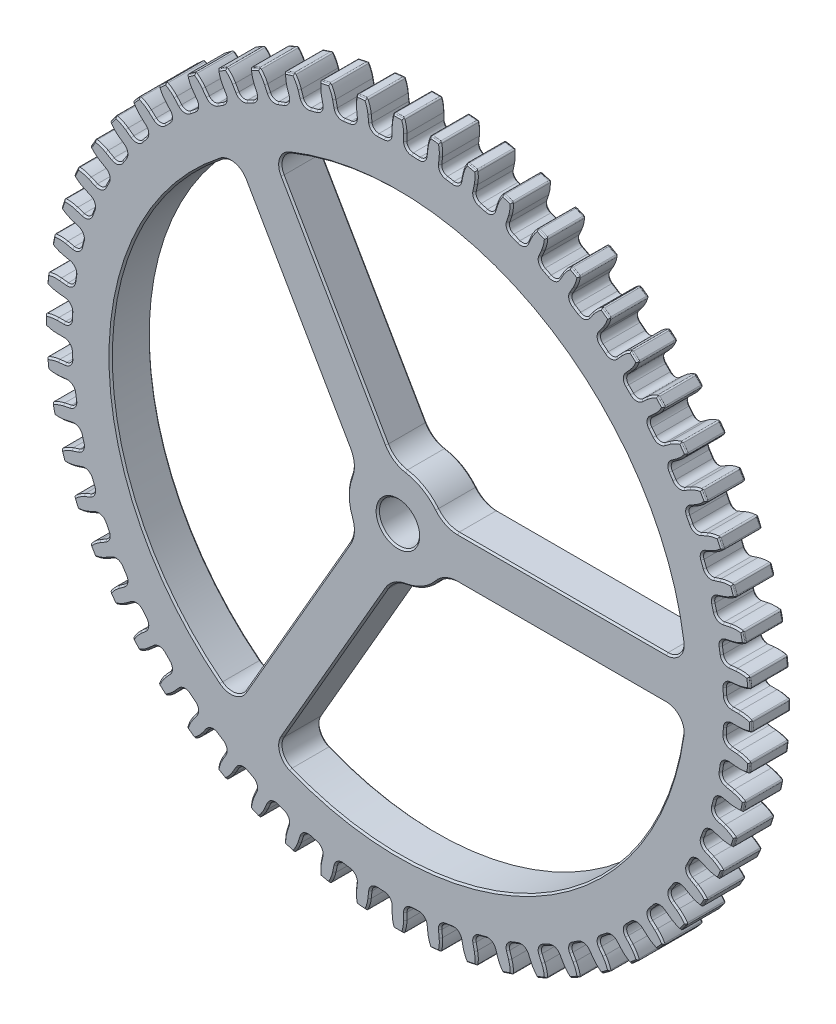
SolidWorks part; units mm, degrees
ref_plane "Спереди" through (0, 0, 0) normal (0, 0, 1) x (1, 0, 0)
ref_plane "Сверху" through (0, 0, 0) normal (0, 1, 0) x (1, 0, 0)
ref_plane "Справа" through (0, 0, 0) normal (1, 0, 0) x (0, 0, -1)
sketch "Эскиз1" plane through (0, 0, 0) normal (0, 0, 1) x (1, 0, 0)
  line L0 (0, 0) -> (0, 52.7) construction
  line L1 (0, 0) -> (-24.4375, 42.327) construction
  line L2 (-7.278, 6.1058) -> (-22.8555, 33.0868)
  line L3 (8.9268, 3.25) -> (40.0817, 3.25)
  line L4 (-1.6488, 9.3558) -> (-17.2263, 36.3368)
  line L5 (8.9268, -3.25) -> (40.0817, -3.25)
  line L6 (-1.6488, -9.3558) -> (-17.2263, -36.3368)
  line L7 (-7.278, -6.1058) -> (-22.8555, -33.0868)
  line L8 (0, 0) -> (42.878, 0) construction
  line L9 (0, 0) -> (-21.439, -37.1334) construction
  line L11 (-1.1, 49.8308) -> (-1.1, 50.8507)
  line L12 (1.1, 49.8308) -> (1.1, 50.8507)
  line L13 (4.1148, 49.6728) -> (4.2214, 50.6871)
  line L14 (6.3027, 49.4428) -> (6.4093, 50.4571)
  line L15 (9.2844, 48.9706) -> (9.4965, 49.9682)
  line L16 (11.4364, 48.5131) -> (11.6484, 49.5108)
  line L17 (14.3524, 47.7318) -> (14.6676, 48.7018)
  line L18 (16.4447, 47.052) -> (16.7599, 48.0219)
  line L19 (19.2631, 45.9701) -> (19.6779, 46.9018)
  line L20 (21.2729, 45.0753) -> (21.6877, 46.007)
  line L21 (23.9628, 43.7047) -> (24.4727, 44.588)
  line L22 (25.868, 42.6047) -> (26.378, 43.488)
  line L23 (28.3999, 40.9605) -> (28.9994, 41.7856)
  line L24 (30.1797, 39.6674) -> (30.7792, 40.4925)
  line L25 (32.5258, 37.7675) -> (33.2083, 38.5255)
  line L26 (34.1608, 36.2954) -> (34.8432, 37.0534)
  line L27 (36.2954, 34.1608) -> (37.0534, 34.8432)
  line L28 (37.7675, 32.5258) -> (38.5255, 33.2083)
  line L29 (39.6674, 30.1797) -> (40.4925, 30.7792)
  line L30 (40.9605, 28.3999) -> (41.7856, 28.9994)
  line L31 (42.6047, 25.868) -> (43.488, 26.378)
  line L32 (43.7047, 23.9628) -> (44.588, 24.4727)
  line L33 (45.0753, 21.2729) -> (46.007, 21.6877)
  line L34 (45.9701, 19.2631) -> (46.9018, 19.6779)
  line L35 (47.052, 16.4447) -> (48.0219, 16.7599)
  line L36 (47.7318, 14.3524) -> (48.7018, 14.6676)
  line L37 (48.5131, 11.4364) -> (49.5108, 11.6484)
  line L38 (48.9706, 9.2844) -> (49.9682, 9.4965)
  line L39 (49.4428, 6.3027) -> (50.4571, 6.4093)
  line L40 (49.6728, 4.1148) -> (50.6871, 4.2214)
  line L41 (49.8308, 1.1) -> (50.8507, 1.1)
  line L42 (49.8308, -1.1) -> (50.8507, -1.1)
  line L43 (49.6728, -4.1148) -> (50.6871, -4.2214)
  line L44 (49.4428, -6.3027) -> (50.4571, -6.4093)
  line L45 (48.9706, -9.2844) -> (49.9682, -9.4965)
  line L46 (48.5131, -11.4364) -> (49.5108, -11.6484)
  line L47 (47.7318, -14.3524) -> (48.7018, -14.6676)
  line L48 (47.052, -16.4447) -> (48.0219, -16.7599)
  line L49 (45.9701, -19.2631) -> (46.9018, -19.6779)
  line L50 (45.0753, -21.2729) -> (46.007, -21.6877)
  line L51 (43.7047, -23.9628) -> (44.588, -24.4727)
  line L52 (42.6047, -25.868) -> (43.488, -26.378)
  line L53 (40.9605, -28.3999) -> (41.7856, -28.9994)
  line L54 (39.6674, -30.1797) -> (40.4925, -30.7792)
  line L55 (37.7675, -32.5258) -> (38.5255, -33.2083)
  line L56 (36.2954, -34.1608) -> (37.0534, -34.8432)
  line L57 (34.1608, -36.2954) -> (34.8432, -37.0534)
  line L58 (32.5258, -37.7675) -> (33.2083, -38.5255)
  line L59 (30.1797, -39.6674) -> (30.7792, -40.4925)
  line L60 (28.3999, -40.9605) -> (28.9994, -41.7856)
  line L61 (25.868, -42.6047) -> (26.378, -43.488)
  line L62 (23.9628, -43.7047) -> (24.4727, -44.588)
  line L63 (21.2729, -45.0753) -> (21.6877, -46.007)
  line L64 (19.2631, -45.9701) -> (19.6779, -46.9018)
  line L65 (16.4447, -47.052) -> (16.7599, -48.0219)
  line L66 (14.3524, -47.7318) -> (14.6676, -48.7018)
  line L67 (11.4364, -48.5131) -> (11.6484, -49.5108)
  line L68 (9.2844, -48.9706) -> (9.4965, -49.9682)
  line L69 (6.3027, -49.4428) -> (6.4093, -50.4571)
  line L70 (4.1148, -49.6728) -> (4.2214, -50.6871)
  line L71 (1.1, -49.8308) -> (1.1, -50.8507)
  line L72 (-1.1, -49.8308) -> (-1.1, -50.8507)
  line L73 (-4.1148, -49.6728) -> (-4.2214, -50.6871)
  line L74 (-6.3027, -49.4428) -> (-6.4093, -50.4571)
  line L75 (-9.2844, -48.9706) -> (-9.4965, -49.9682)
  line L76 (-11.4364, -48.5131) -> (-11.6484, -49.5108)
  line L77 (-14.3524, -47.7318) -> (-14.6676, -48.7018)
  line L78 (-16.4447, -47.052) -> (-16.7599, -48.0219)
  line L79 (-19.2631, -45.9701) -> (-19.6779, -46.9018)
  line L80 (-21.2729, -45.0753) -> (-21.6877, -46.007)
  line L81 (-23.9628, -43.7047) -> (-24.4727, -44.588)
  line L82 (-25.868, -42.6047) -> (-26.378, -43.488)
  line L83 (-28.3999, -40.9605) -> (-28.9994, -41.7856)
  line L84 (-30.1797, -39.6674) -> (-30.7792, -40.4925)
  line L85 (-32.5258, -37.7675) -> (-33.2083, -38.5255)
  line L86 (-34.1608, -36.2954) -> (-34.8432, -37.0534)
  line L87 (-36.2954, -34.1608) -> (-37.0534, -34.8432)
  line L88 (-37.7675, -32.5258) -> (-38.5255, -33.2083)
  line L89 (-39.6674, -30.1797) -> (-40.4925, -30.7792)
  line L90 (-40.9605, -28.3999) -> (-41.7856, -28.9994)
  line L91 (-42.6047, -25.868) -> (-43.488, -26.378)
  line L92 (-43.7047, -23.9628) -> (-44.588, -24.4727)
  line L93 (-45.0753, -21.2729) -> (-46.007, -21.6877)
  line L94 (-45.9701, -19.2631) -> (-46.9018, -19.6779)
  line L95 (-47.052, -16.4447) -> (-48.0219, -16.7599)
  line L96 (-47.7318, -14.3524) -> (-48.7018, -14.6676)
  line L97 (-48.5131, -11.4364) -> (-49.5108, -11.6484)
  line L98 (-48.9706, -9.2844) -> (-49.9682, -9.4965)
  line L99 (-49.4428, -6.3027) -> (-50.4571, -6.4093)
  line L100 (-49.6728, -4.1148) -> (-50.6871, -4.2214)
  line L101 (-49.8308, -1.1) -> (-50.8507, -1.1)
  line L102 (-49.8308, 1.1) -> (-50.8507, 1.1)
  line L103 (-49.6728, 4.1148) -> (-50.6871, 4.2214)
  line L104 (-49.4428, 6.3027) -> (-50.4571, 6.4093)
  line L105 (-48.9706, 9.2844) -> (-49.9682, 9.4965)
  line L106 (-48.5131, 11.4364) -> (-49.5108, 11.6484)
  line L107 (-47.7318, 14.3524) -> (-48.7018, 14.6676)
  line L108 (-47.052, 16.4447) -> (-48.0219, 16.7599)
  line L109 (-45.9701, 19.2631) -> (-46.9018, 19.6779)
  line L110 (-45.0753, 21.2729) -> (-46.007, 21.6877)
  line L111 (-43.7047, 23.9628) -> (-44.588, 24.4727)
  line L112 (-42.6047, 25.868) -> (-43.488, 26.378)
  line L113 (-40.9605, 28.3999) -> (-41.7856, 28.9994)
  line L114 (-39.6674, 30.1797) -> (-40.4925, 30.7792)
  line L115 (-37.7675, 32.5258) -> (-38.5255, 33.2083)
  line L116 (-36.2954, 34.1608) -> (-37.0534, 34.8432)
  line L117 (-34.1608, 36.2954) -> (-34.8432, 37.0534)
  line L118 (-32.5258, 37.7675) -> (-33.2083, 38.5255)
  line L119 (-30.1797, 39.6674) -> (-30.7792, 40.4925)
  line L120 (-28.3999, 40.9605) -> (-28.9994, 41.7856)
  line L121 (-25.868, 42.6047) -> (-26.378, 43.488)
  line L122 (-23.9628, 43.7047) -> (-24.4727, 44.588)
  line L123 (-21.2729, 45.0753) -> (-21.6877, 46.007)
  line L124 (-19.2631, 45.9701) -> (-19.6779, 46.9018)
  line L125 (-16.4447, 47.052) -> (-16.7599, 48.0219)
  line L126 (-14.3524, 47.7318) -> (-14.6676, 48.7018)
  line L127 (-11.4364, 48.5131) -> (-11.6484, 49.5108)
  line L128 (-9.2844, 48.9706) -> (-9.4965, 49.9682)
  line L129 (-6.3027, 49.4428) -> (-6.4093, 50.4571)
  line L130 (-4.1148, 49.6728) -> (-4.2214, 50.6871)
  arc A0 (0.7475, 52.6947) -> (-0.7475, 52.6947) centre (0, 0) ccw
  circle A1 centre (0, 0) radius 51 construction
  arc A2 (-2.0579, 48.8317) -> (-3.0577, 48.7793) centre (0, 0) ccw
  circle A3 centre (0, 0) radius 3
  arc A4 (1.1839, -7.406) -> (5.8218, -4.7283) centre (0, 0) ccw
  arc A5 (42.4582, 5.985) -> (-16.046, 39.7624) centre (0, 0) ccw
  arc A6 (-7.0057, 2.6777) -> (-7.0057, -2.6777) centre (0, 0) ccw
  arc A7 (5.8218, 4.7283) -> (1.1839, 7.406) centre (0, 0) ccw
  arc A8 (-16.046, -39.7624) -> (42.4582, -5.985) centre (0, 0) ccw
  arc A9 (-26.4123, 33.7774) -> (-26.4123, -33.7774) centre (0, 0) ccw
  arc A10 (-22.8555, -33.0868) -> (-26.4123, -33.7774) centre (-24.9339, -31.8868) cw
  arc A11 (-17.2263, -36.3368) -> (-16.046, -39.7624) centre (-15.1478, -37.5368) ccw
  arc A12 (40.0817, -3.25) -> (42.4582, -5.985) centre (40.0817, -5.65) cw
  arc A13 (40.0817, 3.25) -> (42.4582, 5.985) centre (40.0817, 5.65) ccw
  arc A14 (-17.2263, 36.3368) -> (-16.046, 39.7624) centre (-15.1478, 37.5368) cw
  arc A15 (-22.8555, 33.0868) -> (-26.4123, 33.7774) centre (-24.9339, 31.8868) ccw
  arc A16 (-1.6488, -9.3558) -> (1.1839, -7.406) centre (1.8153, -11.3558) cw
  arc A17 (8.9268, -3.25) -> (5.8218, -4.7283) centre (8.9268, -7.25) ccw
  arc A18 (-7.278, -6.1058) -> (-7.0057, -2.6777) centre (-10.7421, -4.1058) ccw
  arc A19 (-7.278, 6.1058) -> (-7.0057, 2.6777) centre (-10.7421, 4.1058) cw
  arc A20 (-1.6488, 9.3558) -> (1.1839, 7.406) centre (1.8153, 11.3558) ccw
  arc A21 (8.9268, 3.25) -> (5.8218, 4.7283) centre (8.9268, 7.25) cw
  arc A22 (-0.7475, 52.6947) -> (-1.1, 50.8507) centre (3.9, 50.8507) ccw
  arc A23 (0.7475, 52.6947) -> (1.1, 50.8507) centre (-3.9, 50.8507) cw
  arc A24 (6.2515, 52.3279) -> (4.7647, 52.4842) centre (0, 0) ccw
  arc A25 (4.7647, 52.4842) -> (4.2214, 50.6871) centre (9.194, 50.1644) ccw
  arc A26 (6.2515, 52.3279) -> (6.4093, 50.4571) centre (1.4367, 50.9798) cw
  arc A27 (11.687, 51.3878) -> (10.2246, 51.6986) centre (0, 0) ccw
  arc A28 (10.2246, 51.6986) -> (9.4965, 49.9682) centre (14.3872, 48.9286) ccw
  arc A29 (11.687, 51.3878) -> (11.6484, 49.5108) centre (6.7577, 50.5503) cw
  arc A30 (16.9945, 49.8846) -> (15.5726, 50.3466) centre (0, 0) ccw
  arc A31 (15.5726, 50.3466) -> (14.6676, 48.7018) centre (19.4228, 47.1567) ccw
  arc A32 (16.9945, 49.8846) -> (16.7599, 48.0219) centre (12.0046, 49.567) cw
  arc A33 (22.1158, 47.835) -> (20.75, 48.443) centre (0, 0) ccw
  arc A34 (20.75, 48.443) -> (19.6779, 46.9018) centre (24.2457, 44.8681) ccw
  arc A35 (22.1158, 47.835) -> (21.6877, 46.007) centre (17.12, 48.0407) cw
  arc A36 (26.9947, 45.2612) -> (25.7, 46.0087) centre (0, 0) ccw
  arc A37 (25.7, 46.0087) -> (24.4727, 44.588) centre (28.8028, 42.088) ccw
  arc A38 (26.9947, 45.2612) -> (26.378, 43.488) centre (22.0478, 45.988) cw
  arc A39 (31.5779, 42.1915) -> (30.3684, 43.0703) centre (0, 0) ccw
  arc A40 (30.3684, 43.0703) -> (28.9994, 41.7856) centre (33.0444, 38.8467) ccw
  arc A41 (31.5779, 42.1915) -> (30.7792, 40.4925) centre (26.7341, 43.4314) cw
  arc A42 (35.8152, 38.6596) -> (34.7041, 39.66) centre (0, 0) ccw
  arc A43 (34.7041, 39.66) -> (33.2083, 38.5255) centre (36.924, 35.1798) ccw
  arc A44 (35.8152, 38.6596) -> (34.8432, 37.0534) centre (31.1275, 40.399) cw
  arc A45 (39.66, 34.7041) -> (38.6596, 35.8152) centre (0, 0) ccw
  arc A46 (38.6596, 35.8152) -> (37.0534, 34.8432) centre (40.399, 31.1275) ccw
  arc A47 (39.66, 34.7041) -> (38.5255, 33.2083) centre (35.1798, 36.924) cw
  arc A48 (43.0703, 30.3684) -> (42.1915, 31.5779) centre (0, 0) ccw
  arc A49 (42.1915, 31.5779) -> (40.4925, 30.7792) centre (43.4314, 26.7341) ccw
  arc A50 (43.0703, 30.3684) -> (41.7856, 28.9994) centre (38.8467, 33.0444) cw
  arc A51 (46.0087, 25.7) -> (45.2612, 26.9947) centre (0, 0) ccw
  arc A52 (45.2612, 26.9947) -> (43.488, 26.378) centre (45.988, 22.0478) ccw
  arc A53 (46.0087, 25.7) -> (44.588, 24.4727) centre (42.088, 28.8028) cw
  arc A54 (48.443, 20.75) -> (47.835, 22.1158) centre (0, 0) ccw
  arc A55 (47.835, 22.1158) -> (46.007, 21.6877) centre (48.0407, 17.12) ccw
  arc A56 (48.443, 20.75) -> (46.9018, 19.6779) centre (44.8681, 24.2457) cw
  arc A57 (50.3466, 15.5726) -> (49.8846, 16.9945) centre (0, 0) ccw
  arc A58 (49.8846, 16.9945) -> (48.0219, 16.7599) centre (49.567, 12.0046) ccw
  arc A59 (50.3466, 15.5726) -> (48.7018, 14.6676) centre (47.1567, 19.4228) cw
  arc A60 (51.6986, 10.2246) -> (51.3878, 11.687) centre (0, 0) ccw
  arc A61 (51.3878, 11.687) -> (49.5108, 11.6484) centre (50.5503, 6.7577) ccw
  arc A62 (51.6986, 10.2246) -> (49.9682, 9.4965) centre (48.9286, 14.3872) cw
  arc A63 (52.4842, 4.7647) -> (52.3279, 6.2515) centre (0, 0) ccw
  arc A64 (52.3279, 6.2515) -> (50.4571, 6.4093) centre (50.9798, 1.4367) ccw
  arc A65 (52.4842, 4.7647) -> (50.6871, 4.2214) centre (50.1644, 9.194) cw
  arc A66 (52.6947, -0.7475) -> (52.6947, 0.7475) centre (0, 0) ccw
  arc A67 (52.6947, 0.7475) -> (50.8507, 1.1) centre (50.8507, -3.9) ccw
  arc A68 (52.6947, -0.7475) -> (50.8507, -1.1) centre (50.8507, 3.9) cw
  arc A69 (52.3279, -6.2515) -> (52.4842, -4.7647) centre (0, 0) ccw
  arc A70 (52.4842, -4.7647) -> (50.6871, -4.2214) centre (50.1644, -9.194) ccw
  arc A71 (52.3279, -6.2515) -> (50.4571, -6.4093) centre (50.9798, -1.4367) cw
  arc A72 (51.3878, -11.687) -> (51.6986, -10.2246) centre (0, 0) ccw
  arc A73 (51.6986, -10.2246) -> (49.9682, -9.4965) centre (48.9286, -14.3872) ccw
  arc A74 (51.3878, -11.687) -> (49.5108, -11.6484) centre (50.5503, -6.7577) cw
  arc A75 (49.8846, -16.9945) -> (50.3466, -15.5726) centre (0, 0) ccw
  arc A76 (50.3466, -15.5726) -> (48.7018, -14.6676) centre (47.1567, -19.4228) ccw
  arc A77 (49.8846, -16.9945) -> (48.0219, -16.7599) centre (49.567, -12.0046) cw
  arc A78 (47.835, -22.1158) -> (48.443, -20.75) centre (0, 0) ccw
  arc A79 (48.443, -20.75) -> (46.9018, -19.6779) centre (44.8681, -24.2457) ccw
  arc A80 (47.835, -22.1158) -> (46.007, -21.6877) centre (48.0407, -17.12) cw
  arc A81 (45.2612, -26.9947) -> (46.0087, -25.7) centre (0, 0) ccw
  arc A82 (46.0087, -25.7) -> (44.588, -24.4727) centre (42.088, -28.8028) ccw
  arc A83 (45.2612, -26.9947) -> (43.488, -26.378) centre (45.988, -22.0478) cw
  arc A84 (42.1915, -31.5779) -> (43.0703, -30.3684) centre (0, 0) ccw
  arc A85 (43.0703, -30.3684) -> (41.7856, -28.9994) centre (38.8467, -33.0444) ccw
  arc A86 (42.1915, -31.5779) -> (40.4925, -30.7792) centre (43.4314, -26.7341) cw
  arc A87 (38.6596, -35.8152) -> (39.66, -34.7041) centre (0, 0) ccw
  arc A88 (39.66, -34.7041) -> (38.5255, -33.2083) centre (35.1798, -36.924) ccw
  arc A89 (38.6596, -35.8152) -> (37.0534, -34.8432) centre (40.399, -31.1275) cw
  arc A90 (34.7041, -39.66) -> (35.8152, -38.6596) centre (0, 0) ccw
  arc A91 (35.8152, -38.6596) -> (34.8432, -37.0534) centre (31.1275, -40.399) ccw
  arc A92 (34.7041, -39.66) -> (33.2083, -38.5255) centre (36.924, -35.1798) cw
  arc A93 (30.3684, -43.0703) -> (31.5779, -42.1915) centre (0, 0) ccw
  arc A94 (31.5779, -42.1915) -> (30.7792, -40.4925) centre (26.7341, -43.4314) ccw
  arc A95 (30.3684, -43.0703) -> (28.9994, -41.7856) centre (33.0444, -38.8467) cw
  arc A96 (25.7, -46.0087) -> (26.9947, -45.2612) centre (0, 0) ccw
  arc A97 (26.9947, -45.2612) -> (26.378, -43.488) centre (22.0478, -45.988) ccw
  arc A98 (25.7, -46.0087) -> (24.4727, -44.588) centre (28.8028, -42.088) cw
  arc A99 (20.75, -48.443) -> (22.1158, -47.835) centre (0, 0) ccw
  arc A100 (22.1158, -47.835) -> (21.6877, -46.007) centre (17.12, -48.0407) ccw
  arc A101 (20.75, -48.443) -> (19.6779, -46.9018) centre (24.2457, -44.8681) cw
  arc A102 (15.5726, -50.3466) -> (16.9945, -49.8846) centre (0, 0) ccw
  arc A103 (16.9945, -49.8846) -> (16.7599, -48.0219) centre (12.0046, -49.567) ccw
  arc A104 (15.5726, -50.3466) -> (14.6676, -48.7018) centre (19.4228, -47.1567) cw
  arc A105 (10.2246, -51.6986) -> (11.687, -51.3878) centre (0, 0) ccw
  arc A106 (11.687, -51.3878) -> (11.6484, -49.5108) centre (6.7577, -50.5503) ccw
  arc A107 (10.2246, -51.6986) -> (9.4965, -49.9682) centre (14.3872, -48.9286) cw
  arc A108 (4.7647, -52.4842) -> (6.2515, -52.3279) centre (0, 0) ccw
  arc A109 (6.2515, -52.3279) -> (6.4093, -50.4571) centre (1.4367, -50.9798) ccw
  arc A110 (4.7647, -52.4842) -> (4.2214, -50.6871) centre (9.194, -50.1644) cw
  arc A111 (-0.7475, -52.6947) -> (0.7475, -52.6947) centre (0, 0) ccw
  arc A112 (0.7475, -52.6947) -> (1.1, -50.8507) centre (-3.9, -50.8507) ccw
  arc A113 (-0.7475, -52.6947) -> (-1.1, -50.8507) centre (3.9, -50.8507) cw
  arc A114 (-6.2515, -52.3279) -> (-4.7647, -52.4842) centre (0, 0) ccw
  arc A115 (-4.7647, -52.4842) -> (-4.2214, -50.6871) centre (-9.194, -50.1644) ccw
  arc A116 (-6.2515, -52.3279) -> (-6.4093, -50.4571) centre (-1.4367, -50.9798) cw
  arc A117 (-11.687, -51.3878) -> (-10.2246, -51.6986) centre (0, 0) ccw
  arc A118 (-10.2246, -51.6986) -> (-9.4965, -49.9682) centre (-14.3872, -48.9286) ccw
  arc A119 (-11.687, -51.3878) -> (-11.6484, -49.5108) centre (-6.7577, -50.5503) cw
  arc A120 (-16.9945, -49.8846) -> (-15.5726, -50.3466) centre (0, 0) ccw
  arc A121 (-15.5726, -50.3466) -> (-14.6676, -48.7018) centre (-19.4228, -47.1567) ccw
  arc A122 (-16.9945, -49.8846) -> (-16.7599, -48.0219) centre (-12.0046, -49.567) cw
  arc A123 (-22.1158, -47.835) -> (-20.75, -48.443) centre (0, 0) ccw
  arc A124 (-20.75, -48.443) -> (-19.6779, -46.9018) centre (-24.2457, -44.8681) ccw
  arc A125 (-22.1158, -47.835) -> (-21.6877, -46.007) centre (-17.12, -48.0407) cw
  arc A126 (-26.9947, -45.2612) -> (-25.7, -46.0087) centre (0, 0) ccw
  arc A127 (-25.7, -46.0087) -> (-24.4727, -44.588) centre (-28.8028, -42.088) ccw
  arc A128 (-26.9947, -45.2612) -> (-26.378, -43.488) centre (-22.0478, -45.988) cw
  arc A129 (-31.5779, -42.1915) -> (-30.3684, -43.0703) centre (0, 0) ccw
  arc A130 (-30.3684, -43.0703) -> (-28.9994, -41.7856) centre (-33.0444, -38.8467) ccw
  arc A131 (-31.5779, -42.1915) -> (-30.7792, -40.4925) centre (-26.7341, -43.4314) cw
  arc A132 (-35.8152, -38.6596) -> (-34.7041, -39.66) centre (0, 0) ccw
  arc A133 (-34.7041, -39.66) -> (-33.2083, -38.5255) centre (-36.924, -35.1798) ccw
  arc A134 (-35.8152, -38.6596) -> (-34.8432, -37.0534) centre (-31.1275, -40.399) cw
  arc A135 (-39.66, -34.7041) -> (-38.6596, -35.8152) centre (0, 0) ccw
  arc A136 (-38.6596, -35.8152) -> (-37.0534, -34.8432) centre (-40.399, -31.1275) ccw
  arc A137 (-39.66, -34.7041) -> (-38.5255, -33.2083) centre (-35.1798, -36.924) cw
  arc A138 (-43.0703, -30.3684) -> (-42.1915, -31.5779) centre (0, 0) ccw
  arc A139 (-42.1915, -31.5779) -> (-40.4925, -30.7792) centre (-43.4314, -26.7341) ccw
  arc A140 (-43.0703, -30.3684) -> (-41.7856, -28.9994) centre (-38.8467, -33.0444) cw
  arc A141 (-46.0087, -25.7) -> (-45.2612, -26.9947) centre (0, 0) ccw
  arc A142 (-45.2612, -26.9947) -> (-43.488, -26.378) centre (-45.988, -22.0478) ccw
  arc A143 (-46.0087, -25.7) -> (-44.588, -24.4727) centre (-42.088, -28.8028) cw
  arc A144 (-48.443, -20.75) -> (-47.835, -22.1158) centre (0, 0) ccw
  arc A145 (-47.835, -22.1158) -> (-46.007, -21.6877) centre (-48.0407, -17.12) ccw
  arc A146 (-48.443, -20.75) -> (-46.9018, -19.6779) centre (-44.8681, -24.2457) cw
  arc A147 (-50.3466, -15.5726) -> (-49.8846, -16.9945) centre (0, 0) ccw
  arc A148 (-49.8846, -16.9945) -> (-48.0219, -16.7599) centre (-49.567, -12.0046) ccw
  arc A149 (-50.3466, -15.5726) -> (-48.7018, -14.6676) centre (-47.1567, -19.4228) cw
  arc A150 (-51.6986, -10.2246) -> (-51.3878, -11.687) centre (0, 0) ccw
  arc A151 (-51.3878, -11.687) -> (-49.5108, -11.6484) centre (-50.5503, -6.7577) ccw
  arc A152 (-51.6986, -10.2246) -> (-49.9682, -9.4965) centre (-48.9286, -14.3872) cw
  arc A153 (-52.4842, -4.7647) -> (-52.3279, -6.2515) centre (0, 0) ccw
  arc A154 (-52.3279, -6.2515) -> (-50.4571, -6.4093) centre (-50.9798, -1.4367) ccw
  arc A155 (-52.4842, -4.7647) -> (-50.6871, -4.2214) centre (-50.1644, -9.194) cw
  arc A156 (-52.6947, 0.7475) -> (-52.6947, -0.7475) centre (0, 0) ccw
  arc A157 (-52.6947, -0.7475) -> (-50.8507, -1.1) centre (-50.8507, 3.9) ccw
  arc A158 (-52.6947, 0.7475) -> (-50.8507, 1.1) centre (-50.8507, -3.9) cw
  arc A159 (-52.3279, 6.2515) -> (-52.4842, 4.7647) centre (0, 0) ccw
  arc A160 (-52.4842, 4.7647) -> (-50.6871, 4.2214) centre (-50.1644, 9.194) ccw
  arc A161 (-52.3279, 6.2515) -> (-50.4571, 6.4093) centre (-50.9798, 1.4367) cw
  arc A162 (-51.3878, 11.687) -> (-51.6986, 10.2246) centre (0, 0) ccw
  arc A163 (-51.6986, 10.2246) -> (-49.9682, 9.4965) centre (-48.9286, 14.3872) ccw
  arc A164 (-51.3878, 11.687) -> (-49.5108, 11.6484) centre (-50.5503, 6.7577) cw
  arc A165 (-49.8846, 16.9945) -> (-50.3466, 15.5726) centre (0, 0) ccw
  arc A166 (-50.3466, 15.5726) -> (-48.7018, 14.6676) centre (-47.1567, 19.4228) ccw
  arc A167 (-49.8846, 16.9945) -> (-48.0219, 16.7599) centre (-49.567, 12.0046) cw
  arc A168 (-47.835, 22.1158) -> (-48.443, 20.75) centre (0, 0) ccw
  arc A169 (-48.443, 20.75) -> (-46.9018, 19.6779) centre (-44.8681, 24.2457) ccw
  arc A170 (-47.835, 22.1158) -> (-46.007, 21.6877) centre (-48.0407, 17.12) cw
  arc A171 (-45.2612, 26.9947) -> (-46.0087, 25.7) centre (0, 0) ccw
  arc A172 (-46.0087, 25.7) -> (-44.588, 24.4727) centre (-42.088, 28.8028) ccw
  arc A173 (-45.2612, 26.9947) -> (-43.488, 26.378) centre (-45.988, 22.0478) cw
  arc A174 (-42.1915, 31.5779) -> (-43.0703, 30.3684) centre (0, 0) ccw
  arc A175 (-43.0703, 30.3684) -> (-41.7856, 28.9994) centre (-38.8467, 33.0444) ccw
  arc A176 (-42.1915, 31.5779) -> (-40.4925, 30.7792) centre (-43.4314, 26.7341) cw
  arc A177 (-38.6596, 35.8152) -> (-39.66, 34.7041) centre (0, 0) ccw
  arc A178 (-39.66, 34.7041) -> (-38.5255, 33.2083) centre (-35.1798, 36.924) ccw
  arc A179 (-38.6596, 35.8152) -> (-37.0534, 34.8432) centre (-40.399, 31.1275) cw
  arc A180 (-34.7041, 39.66) -> (-35.8152, 38.6596) centre (0, 0) ccw
  arc A181 (-35.8152, 38.6596) -> (-34.8432, 37.0534) centre (-31.1275, 40.399) ccw
  arc A182 (-34.7041, 39.66) -> (-33.2083, 38.5255) centre (-36.924, 35.1798) cw
  arc A183 (-30.3684, 43.0703) -> (-31.5779, 42.1915) centre (0, 0) ccw
  arc A184 (-31.5779, 42.1915) -> (-30.7792, 40.4925) centre (-26.7341, 43.4314) ccw
  arc A185 (-30.3684, 43.0703) -> (-28.9994, 41.7856) centre (-33.0444, 38.8467) cw
  arc A186 (-25.7, 46.0087) -> (-26.9947, 45.2612) centre (0, 0) ccw
  arc A187 (-26.9947, 45.2612) -> (-26.378, 43.488) centre (-22.0478, 45.988) ccw
  arc A188 (-25.7, 46.0087) -> (-24.4727, 44.588) centre (-28.8028, 42.088) cw
  arc A189 (-20.75, 48.443) -> (-22.1158, 47.835) centre (0, 0) ccw
  arc A190 (-22.1158, 47.835) -> (-21.6877, 46.007) centre (-17.12, 48.0407) ccw
  arc A191 (-20.75, 48.443) -> (-19.6779, 46.9018) centre (-24.2457, 44.8681) cw
  arc A192 (-15.5726, 50.3466) -> (-16.9945, 49.8846) centre (0, 0) ccw
  arc A193 (-16.9945, 49.8846) -> (-16.7599, 48.0219) centre (-12.0046, 49.567) ccw
  arc A194 (-15.5726, 50.3466) -> (-14.6676, 48.7018) centre (-19.4228, 47.1567) cw
  arc A195 (-10.2246, 51.6986) -> (-11.687, 51.3878) centre (0, 0) ccw
  arc A196 (-11.687, 51.3878) -> (-11.6484, 49.5108) centre (-6.7577, 50.5503) ccw
  arc A197 (-10.2246, 51.6986) -> (-9.4965, 49.9682) centre (-14.3872, 48.9286) cw
  arc A198 (-4.7647, 52.4842) -> (-6.2515, 52.3279) centre (0, 0) ccw
  arc A199 (-6.2515, 52.3279) -> (-6.4093, 50.4571) centre (-1.4367, 50.9798) ccw
  arc A200 (-4.7647, 52.4842) -> (-4.2214, 50.6871) centre (-9.194, 50.1644) cw
  arc A201 (3.0577, 48.7793) -> (2.0579, 48.8317) centre (0, 0) ccw
  arc A202 (8.1397, 48.1924) -> (7.1509, 48.349) centre (0, 0) ccw
  arc A203 (-7.1509, 48.349) -> (-8.1397, 48.1924) centre (0, 0) ccw
  arc A204 (-12.1656, 47.3367) -> (-13.1326, 47.0776) centre (0, 0) ccw
  arc A205 (-17.047, 45.8057) -> (-17.9816, 45.447) centre (0, 0) ccw
  arc A206 (13.1326, 47.0776) -> (12.1656, 47.3367) centre (0, 0) ccw
  arc A207 (17.9816, 45.447) -> (17.047, 45.8057) centre (0, 0) ccw
  arc A208 (22.6336, 43.3184) -> (21.7416, 43.7729) centre (0, 0) ccw
  arc A209 (-21.7416, 43.7729) -> (-22.6336, 43.3184) centre (0, 0) ccw
  arc A210 (-26.198, 41.2605) -> (-27.0377, 40.7152) centre (0, 0) ccw
  arc A211 (-37.666, 31.1454) -> (-38.296, 30.3674) centre (0, 0) ccw
  arc A212 (-34.2041, 34.912) -> (-34.912, 34.2041) centre (0, 0) ccw
  arc A213 (-30.3674, 38.296) -> (-31.1454, 37.666) centre (0, 0) ccw
  arc A214 (-43.3184, 22.6336) -> (-43.7729, 21.7416) centre (0, 0) ccw
  arc A215 (-40.7152, 27.0377) -> (-41.2605, 26.198) centre (0, 0) ccw
  arc A216 (-45.447, 17.9816) -> (-45.8057, 17.047) centre (0, 0) ccw
  arc A217 (-47.0776, 13.1326) -> (-47.3367, 12.1656) centre (0, 0) ccw
  arc A218 (-48.1924, 8.1397) -> (-48.349, 7.1509) centre (0, 0) ccw
  arc A219 (-48.7793, 3.0577) -> (-48.8317, 2.0579) centre (0, 0) ccw
  arc A220 (-48.8317, -2.0579) -> (-48.7793, -3.0577) centre (0, 0) ccw
  arc A221 (-48.349, -7.1509) -> (-48.1924, -8.1397) centre (0, 0) ccw
  arc A222 (-47.3367, -12.1656) -> (-47.0776, -13.1326) centre (0, 0) ccw
  arc A223 (-45.8057, -17.047) -> (-45.447, -17.9816) centre (0, 0) ccw
  arc A224 (-43.7729, -21.7416) -> (-43.3184, -22.6336) centre (0, 0) ccw
  arc A225 (-41.2605, -26.198) -> (-40.7152, -27.0377) centre (0, 0) ccw
  arc A226 (-38.296, -30.3674) -> (-37.666, -31.1454) centre (0, 0) ccw
  arc A227 (-34.912, -34.2041) -> (-34.2041, -34.912) centre (0, 0) ccw
  arc A228 (-31.1454, -37.666) -> (-30.3674, -38.296) centre (0, 0) ccw
  arc A229 (-27.0377, -40.7152) -> (-26.198, -41.2605) centre (0, 0) ccw
  arc A230 (-22.6336, -43.3184) -> (-21.7416, -43.7729) centre (0, 0) ccw
  arc A231 (-17.9816, -45.447) -> (-17.047, -45.8057) centre (0, 0) ccw
  arc A232 (-13.1326, -47.0776) -> (-12.1656, -47.3367) centre (0, 0) ccw
  arc A233 (-8.1397, -48.1924) -> (-7.1509, -48.349) centre (0, 0) ccw
  arc A234 (-3.0577, -48.7793) -> (-2.0579, -48.8317) centre (0, 0) ccw
  arc A235 (2.0579, -48.8317) -> (3.0577, -48.7793) centre (0, 0) ccw
  arc A236 (7.1509, -48.349) -> (8.1397, -48.1924) centre (0, 0) ccw
  arc A237 (12.1656, -47.3367) -> (13.1326, -47.0776) centre (0, 0) ccw
  arc A238 (17.047, -45.8057) -> (17.9816, -45.447) centre (0, 0) ccw
  arc A239 (21.7416, -43.7729) -> (22.6336, -43.3184) centre (0, 0) ccw
  arc A240 (26.198, -41.2605) -> (27.0377, -40.7152) centre (0, 0) ccw
  arc A241 (30.3674, -38.296) -> (31.1454, -37.666) centre (0, 0) ccw
  arc A242 (34.2041, -34.912) -> (34.912, -34.2041) centre (0, 0) ccw
  arc A243 (37.666, -31.1454) -> (38.296, -30.3674) centre (0, 0) ccw
  arc A244 (40.7152, -27.0377) -> (41.2605, -26.198) centre (0, 0) ccw
  arc A245 (43.3184, -22.6336) -> (43.7729, -21.7416) centre (0, 0) ccw
  arc A246 (45.447, -17.9816) -> (45.8057, -17.047) centre (0, 0) ccw
  arc A247 (47.0776, -13.1326) -> (47.3367, -12.1656) centre (0, 0) ccw
  arc A248 (48.1924, -8.1397) -> (48.349, -7.1509) centre (0, 0) ccw
  arc A249 (43.7729, 21.7416) -> (43.3184, 22.6336) centre (0, 0) ccw
  arc A250 (45.8057, 17.047) -> (45.447, 17.9816) centre (0, 0) ccw
  arc A251 (47.3367, 12.1656) -> (47.0776, 13.1326) centre (0, 0) ccw
  arc A252 (48.349, 7.1509) -> (48.1924, 8.1397) centre (0, 0) ccw
  arc A253 (48.8317, 2.0579) -> (48.7793, 3.0577) centre (0, 0) ccw
  arc A254 (48.7793, -3.0577) -> (48.8317, -2.0579) centre (0, 0) ccw
  arc A255 (41.2605, 26.198) -> (40.7152, 27.0377) centre (0, 0) ccw
  arc A256 (38.296, 30.3674) -> (37.666, 31.1454) centre (0, 0) ccw
  arc A257 (34.912, 34.2041) -> (34.2041, 34.912) centre (0, 0) ccw
  arc A258 (31.1454, 37.666) -> (30.3674, 38.296) centre (0, 0) ccw
  arc A259 (27.0377, 40.7152) -> (26.198, 41.2605) centre (0, 0) ccw
  arc A260 (-45.9701, 19.2631) -> (-45.447, 17.9816) centre (-46.3768, 18.3496) cw
  arc A261 (-47.052, 16.4447) -> (-45.8057, 17.047) centre (-46.7429, 17.3958) ccw
  arc A262 (-45.0753, 21.2729) -> (-43.7729, 21.7416) centre (-44.6685, 22.1864) ccw
  arc A263 (-43.7047, 23.9628) -> (-43.3184, 22.6336) centre (-44.2047, 23.0967) cw
  arc A264 (-42.6047, 25.868) -> (-41.2605, 26.198) centre (-42.1047, 26.734) ccw
  arc A265 (-40.9605, 28.3999) -> (-40.7152, 27.0377) centre (-41.5483, 27.5909) cw
  arc A266 (-39.6674, 30.1797) -> (-38.296, 30.3674) centre (-39.0796, 30.9887) ccw
  arc A267 (-37.7675, 32.5258) -> (-37.666, 31.1454) centre (-38.4367, 31.7827) cw
  arc A268 (-36.2954, 34.1608) -> (-34.912, 34.2041) centre (-35.6263, 34.9039) ccw
  arc A269 (-34.1608, 36.2954) -> (-34.2041, 34.912) centre (-34.9039, 35.6263) cw
  arc A270 (-32.5258, 37.7675) -> (-31.1454, 37.666) centre (-31.7827, 38.4367) ccw
  arc A271 (-30.1797, 39.6674) -> (-30.3674, 38.296) centre (-30.9887, 39.0796) cw
  arc A272 (-28.3999, 40.9605) -> (-27.0377, 40.7152) centre (-27.5909, 41.5483) ccw
  arc A273 (-25.868, 42.6047) -> (-26.198, 41.2605) centre (-26.734, 42.1047) cw
  arc A274 (-23.9628, 43.7047) -> (-22.6336, 43.3184) centre (-23.0967, 44.2047) ccw
  arc A275 (-21.2729, 45.0753) -> (-21.7416, 43.7729) centre (-22.1864, 44.6685) cw
  arc A276 (-19.2631, 45.9701) -> (-17.9816, 45.447) centre (-18.3496, 46.3768) ccw
  arc A277 (-16.4447, 47.052) -> (-17.047, 45.8057) centre (-17.3958, 46.7429) cw
  arc A278 (-47.7318, 14.3524) -> (-47.0776, 13.1326) centre (-48.0408, 13.4013) cw
  arc A279 (-48.5131, 11.4364) -> (-47.3367, 12.1656) centre (-48.3052, 12.4145) ccw
  arc A280 (-48.9706, 9.2844) -> (-48.1924, 8.1397) centre (-49.1785, 8.3063) cw
  arc A281 (-49.6728, 4.1148) -> (-48.7793, 3.0577) centre (-49.7773, 3.1202) cw
  arc A282 (-49.4428, 6.3027) -> (-48.349, 7.1509) centre (-49.3383, 7.2972) ccw
  arc A283 (-49.8308, 1.1) -> (-48.8317, 2.0579) centre (-49.8308, 2.1) ccw
  arc A284 (-49.8308, -1.1) -> (-48.8317, -2.0579) centre (-49.8308, -2.1) cw
  arc A285 (-49.6728, -4.1148) -> (-48.7793, -3.0577) centre (-49.7773, -3.1202) ccw
  arc A286 (-49.4428, -6.3027) -> (-48.349, -7.1509) centre (-49.3383, -7.2972) cw
  arc A287 (-48.9706, -9.2844) -> (-48.1924, -8.1397) centre (-49.1785, -8.3063) ccw
  arc A288 (-47.7318, -14.3524) -> (-47.0776, -13.1326) centre (-48.0408, -13.4013) ccw
  arc A289 (-48.5131, -11.4364) -> (-47.3367, -12.1656) centre (-48.3052, -12.4145) cw
  arc A290 (-47.052, -16.4447) -> (-45.8057, -17.047) centre (-46.7429, -17.3958) cw
  arc A291 (-45.9701, -19.2631) -> (-45.447, -17.9816) centre (-46.3768, -18.3496) ccw
  arc A292 (-45.0753, -21.2729) -> (-43.7729, -21.7416) centre (-44.6685, -22.1864) cw
  arc A293 (-43.7047, -23.9628) -> (-43.3184, -22.6336) centre (-44.2047, -23.0967) ccw
  arc A294 (-42.6047, -25.868) -> (-41.2605, -26.198) centre (-42.1047, -26.734) cw
  arc A295 (-40.9605, -28.3999) -> (-40.7152, -27.0377) centre (-41.5483, -27.5909) ccw
  arc A296 (-37.7675, -32.5258) -> (-37.666, -31.1454) centre (-38.4367, -31.7827) ccw
  arc A297 (-39.6674, -30.1797) -> (-38.296, -30.3674) centre (-39.0796, -30.9887) cw
  arc A298 (-36.2954, -34.1608) -> (-34.912, -34.2041) centre (-35.6263, -34.9039) cw
  arc A299 (-34.1608, -36.2954) -> (-34.2041, -34.912) centre (-34.9039, -35.6263) ccw
  arc A300 (-32.5258, -37.7675) -> (-31.1454, -37.666) centre (-31.7827, -38.4367) cw
  arc A301 (-30.1797, -39.6674) -> (-30.3674, -38.296) centre (-30.9887, -39.0796) ccw
  arc A302 (-25.868, -42.6047) -> (-26.198, -41.2605) centre (-26.734, -42.1047) ccw
  arc A303 (-28.3999, -40.9605) -> (-27.0377, -40.7152) centre (-27.5909, -41.5483) cw
  arc A304 (-23.9628, -43.7047) -> (-22.6336, -43.3184) centre (-23.0967, -44.2047) cw
  arc A305 (-21.2729, -45.0753) -> (-21.7416, -43.7729) centre (-22.1864, -44.6685) ccw
  arc A306 (-14.3524, -47.7318) -> (-13.1326, -47.0776) centre (-13.4013, -48.0408) cw
  arc A307 (-16.4447, -47.052) -> (-17.047, -45.8057) centre (-17.3958, -46.7429) ccw
  arc A308 (-19.2631, -45.9701) -> (-17.9816, -45.447) centre (-18.3496, -46.3768) cw
  arc A309 (-11.4364, -48.5131) -> (-12.1656, -47.3367) centre (-12.4145, -48.3052) ccw
  arc A310 (-9.2844, -48.9706) -> (-8.1397, -48.1924) centre (-8.3063, -49.1785) cw
  arc A311 (-6.3027, -49.4428) -> (-7.1509, -48.349) centre (-7.2972, -49.3383) ccw
  arc A312 (-4.1148, -49.6728) -> (-3.0577, -48.7793) centre (-3.1202, -49.7773) cw
  arc A313 (-1.1, -49.8308) -> (-2.0579, -48.8317) centre (-2.1, -49.8308) ccw
  arc A314 (1.1, -49.8308) -> (2.0579, -48.8317) centre (2.1, -49.8308) cw
  arc A315 (4.1148, -49.6728) -> (3.0577, -48.7793) centre (3.1202, -49.7773) ccw
  arc A316 (6.3027, -49.4428) -> (7.1509, -48.349) centre (7.2972, -49.3383) cw
  arc A317 (9.2844, -48.9706) -> (8.1397, -48.1924) centre (8.3063, -49.1785) ccw
  arc A318 (11.4364, -48.5131) -> (12.1656, -47.3367) centre (12.4145, -48.3052) cw
  arc A319 (14.3524, -47.7318) -> (13.1326, -47.0776) centre (13.4013, -48.0408) ccw
  arc A320 (16.4447, -47.052) -> (17.047, -45.8057) centre (17.3958, -46.7429) cw
  arc A321 (19.2631, -45.9701) -> (17.9816, -45.447) centre (18.3496, -46.3768) ccw
  arc A322 (21.2729, -45.0753) -> (21.7416, -43.7729) centre (22.1864, -44.6685) cw
  arc A323 (23.9628, -43.7047) -> (22.6336, -43.3184) centre (23.0967, -44.2047) ccw
  arc A324 (25.868, -42.6047) -> (26.198, -41.2605) centre (26.734, -42.1047) cw
  arc A325 (28.3999, -40.9605) -> (27.0377, -40.7152) centre (27.5909, -41.5483) ccw
  arc A326 (30.1797, -39.6674) -> (30.3674, -38.296) centre (30.9887, -39.0796) cw
  arc A327 (32.5258, -37.7675) -> (31.1454, -37.666) centre (31.7827, -38.4367) ccw
  arc A328 (34.1608, -36.2954) -> (34.2041, -34.912) centre (34.9039, -35.6263) cw
  arc A329 (36.2954, -34.1608) -> (34.912, -34.2041) centre (35.6263, -34.9039) ccw
  arc A330 (37.7675, -32.5258) -> (37.666, -31.1454) centre (38.4367, -31.7827) cw
  arc A331 (39.6674, -30.1797) -> (38.296, -30.3674) centre (39.0796, -30.9887) ccw
  arc A332 (40.9605, -28.3999) -> (40.7152, -27.0377) centre (41.5483, -27.5909) cw
  arc A333 (42.6047, -25.868) -> (41.2605, -26.198) centre (42.1047, -26.734) ccw
  arc A334 (43.7047, -23.9628) -> (43.3184, -22.6336) centre (44.2047, -23.0967) cw
  arc A335 (45.0753, -21.2729) -> (43.7729, -21.7416) centre (44.6685, -22.1864) ccw
  arc A336 (45.9701, -19.2631) -> (45.447, -17.9816) centre (46.3768, -18.3496) cw
  arc A337 (47.052, -16.4447) -> (45.8057, -17.047) centre (46.7429, -17.3958) ccw
  arc A338 (47.7318, -14.3524) -> (47.0776, -13.1326) centre (48.0408, -13.4013) cw
  arc A339 (48.5131, -11.4364) -> (47.3367, -12.1656) centre (48.3052, -12.4145) ccw
  arc A340 (48.9706, -9.2844) -> (48.1924, -8.1397) centre (49.1785, -8.3063) cw
  arc A341 (49.4428, -6.3027) -> (48.349, -7.1509) centre (49.3383, -7.2972) ccw
  arc A342 (49.6728, -4.1148) -> (48.7793, -3.0577) centre (49.7773, -3.1202) cw
  arc A343 (49.8308, -1.1) -> (48.8317, -2.0579) centre (49.8308, -2.1) ccw
  arc A344 (49.8308, 1.1) -> (48.8317, 2.0579) centre (49.8308, 2.1) cw
  arc A345 (49.6728, 4.1148) -> (48.7793, 3.0577) centre (49.7773, 3.1202) ccw
  arc A346 (49.4428, 6.3027) -> (48.349, 7.1509) centre (49.3383, 7.2972) cw
  arc A347 (48.9706, 9.2844) -> (48.1924, 8.1397) centre (49.1785, 8.3063) ccw
  arc A348 (48.5131, 11.4364) -> (47.3367, 12.1656) centre (48.3052, 12.4145) cw
  arc A349 (47.7318, 14.3524) -> (47.0776, 13.1326) centre (48.0408, 13.4013) ccw
  arc A350 (47.052, 16.4447) -> (45.8057, 17.047) centre (46.7429, 17.3958) cw
  arc A351 (45.9701, 19.2631) -> (45.447, 17.9816) centre (46.3768, 18.3496) ccw
  arc A352 (45.0753, 21.2729) -> (43.7729, 21.7416) centre (44.6685, 22.1864) cw
  arc A353 (43.7047, 23.9628) -> (43.3184, 22.6336) centre (44.2047, 23.0967) ccw
  arc A354 (42.6047, 25.868) -> (41.2605, 26.198) centre (42.1047, 26.734) cw
  arc A355 (40.9605, 28.3999) -> (40.7152, 27.0377) centre (41.5483, 27.5909) ccw
  arc A356 (39.6674, 30.1797) -> (38.296, 30.3674) centre (39.0796, 30.9887) cw
  arc A357 (37.7675, 32.5258) -> (37.666, 31.1454) centre (38.4367, 31.7827) ccw
  arc A358 (36.2954, 34.1608) -> (34.912, 34.2041) centre (35.6263, 34.9039) cw
  arc A359 (34.1608, 36.2954) -> (34.2041, 34.912) centre (34.9039, 35.6263) ccw
  arc A360 (32.5258, 37.7675) -> (31.1454, 37.666) centre (31.7827, 38.4367) cw
  arc A361 (30.1797, 39.6674) -> (30.3674, 38.296) centre (30.9887, 39.0796) ccw
  arc A362 (25.868, 42.6047) -> (26.198, 41.2605) centre (26.734, 42.1047) ccw
  arc A363 (28.3999, 40.9605) -> (27.0377, 40.7152) centre (27.5909, 41.5483) cw
  arc A364 (23.9628, 43.7047) -> (22.6336, 43.3184) centre (23.0967, 44.2047) cw
  arc A365 (21.2729, 45.0753) -> (21.7416, 43.7729) centre (22.1864, 44.6685) ccw
  arc A366 (19.2631, 45.9701) -> (17.9816, 45.447) centre (18.3496, 46.3768) cw
  arc A367 (16.4447, 47.052) -> (17.047, 45.8057) centre (17.3958, 46.7429) ccw
  arc A368 (14.3524, 47.7318) -> (13.1326, 47.0776) centre (13.4013, 48.0408) cw
  arc A369 (11.4364, 48.5131) -> (12.1656, 47.3367) centre (12.4145, 48.3052) ccw
  arc A370 (9.2844, 48.9706) -> (8.1397, 48.1924) centre (8.3063, 49.1785) cw
  arc A371 (6.3027, 49.4428) -> (7.1509, 48.349) centre (7.2972, 49.3383) ccw
  arc A372 (4.1148, 49.6728) -> (3.0577, 48.7793) centre (3.1202, 49.7773) cw
  arc A373 (1.1, 49.8308) -> (2.0579, 48.8317) centre (2.1, 49.8308) ccw
  arc A374 (-14.3524, 47.7318) -> (-13.1326, 47.0776) centre (-13.4013, 48.0408) ccw
  arc A375 (-11.4364, 48.5131) -> (-12.1656, 47.3367) centre (-12.4145, 48.3052) cw
  arc A376 (-9.2844, 48.9706) -> (-8.1397, 48.1924) centre (-8.3063, 49.1785) ccw
  arc A377 (-6.3027, 49.4428) -> (-7.1509, 48.349) centre (-7.2972, 49.3383) cw
  arc A378 (-1.1, 49.8308) -> (-2.0579, 48.8317) centre (-2.1, 49.8308) cw
  arc A379 (-4.1148, 49.6728) -> (-3.0577, 48.7793) centre (-3.1202, 49.7773) ccw
  point P1 (-0.7475, 52.6947)
  point P36 (-24.1919, 35.4016)
  point P45 (-6.1942, 4.2287)
  point P63 (4.7647, 52.4842)
  point P73 (10.2246, 51.6986)
  point P83 (15.5726, 50.3466)
  point P93 (20.75, 48.443)
  point P103 (25.7, 46.0087)
  point P113 (30.3684, 43.0703)
  point P123 (34.7041, 39.66)
  point P133 (38.6596, 35.8152)
  point P143 (42.1915, 31.5779)
  point P153 (45.2612, 26.9947)
  point P163 (47.835, 22.1158)
  point P173 (49.8846, 16.9945)
  point P183 (51.3878, 11.687)
  point P193 (52.3279, 6.2515)
  point P203 (52.6947, 0.7475)
  point P213 (52.4842, -4.7647)
  point P223 (51.6986, -10.2246)
  point P233 (50.3466, -15.5726)
  point P243 (48.443, -20.75)
  point P253 (46.0087, -25.7)
  point P263 (43.0703, -30.3684)
  point P273 (39.66, -34.7041)
  point P283 (35.8152, -38.6596)
  point P293 (31.5779, -42.1915)
  point P303 (26.9947, -45.2612)
  point P313 (22.1158, -47.835)
  point P323 (16.9945, -49.8846)
  point P333 (11.687, -51.3878)
  point P343 (6.2515, -52.3279)
  point P353 (0.7475, -52.6947)
  point P363 (-4.7647, -52.4842)
  point P373 (-10.2246, -51.6986)
  point P383 (-15.5726, -50.3466)
  point P393 (-20.75, -48.443)
  point P403 (-25.7, -46.0087)
  point P413 (-30.3684, -43.0703)
  point P423 (-34.7041, -39.66)
  point P433 (-38.6596, -35.8152)
  point P443 (-42.1915, -31.5779)
  point P453 (-45.2612, -26.9947)
  point P463 (-47.835, -22.1158)
  point P473 (-49.8846, -16.9945)
  point P483 (-51.3878, -11.687)
  point P493 (-52.3279, -6.2515)
  point P503 (-52.6947, -0.7475)
  point P513 (-52.4842, 4.7647)
  point P523 (-51.6986, 10.2246)
  point P533 (-50.3466, 15.5726)
  point P543 (-48.443, 20.75)
  point P553 (-46.0087, 25.7)
  point P563 (-43.0703, 30.3684)
  point P573 (-39.66, 34.7041)
  point P583 (-35.8152, 38.6596)
  point P593 (-31.5779, 42.1915)
  point P603 (-26.9947, 45.2612)
  point P613 (-22.1158, 47.835)
  point P623 (-16.9945, 49.8846)
  point P633 (-11.687, 51.3878)
  point P643 (-6.2515, 52.3279)
  point P873 (1.1, 48.8626)
  point P884 (-1.1, 48.8626)
  dimension "D1" = 105.4
  dimension "D2" = 102
  dimension "D3" = 97.75
  dimension "D4" = 6
  dimension "D5" = 15
  dimension "D8" = 85.756
  dimension "D6" = 2.4
  dimension "D13" = 4
  dimension "D14" = 10
  dimension "D17" = 1
  dimension "D7" = 3.25
  dimension "D9" = 3.25
  dimension "D11" = 3.25
  dimension "D12" = 6.5
  dimension "D15" = 2.2
  dimension "D16" = 60
  dimension "D10" = 3
extrude "Бобышка-Вытянуть1" add sketch "Эскиз1" along normal blind 6
chamfer "Фаска1" distance 0.25 angle 45 400 edges at (21.439, 37.1334, 6) (-17.4169, 38.3186, 6) (-9.4375, 22.8463, 6) (-0.4527, 8.0609, 6) (3.75, 6.4952, 6) (7.2073, 3.6384, 6) (24.5043, 3.25, 6) (41.8934, 4.0758, 6) (-15.0667, -19.5963, 6) (-6.7546, -4.4225, 6) (-7.5, 0, 6) (-6.7546, 4.4225, 6) (-15.0667, 19.5963, 6) (-24.4765, 34.2428, 6) (-42.878, 0, 6) (-24.4765, -34.2428, 6) (-46.4359, 19.4705, 6) (-47.7232, 20.141, 6) (-48.1438, 21.435, 6) (-46.9007, 21.9883, 6) (-45.5411, 21.4803, 6) (-44.3299, 21.2455, 6) (-43.5479, 22.1888, 6) (-43.2445, 23.3758, 6) (-44.1463, 24.2177, 6) (-45.3565, 25.0191, 6) (-45.6395, 26.35, 6) (-44.3454, 26.7703, 6) (-43.0463, 26.123, 6) (-41.8663, 25.7629, 6) (-40.99, 26.6192, 6) (-40.5641, 27.7681, 6) (-41.3731, 28.6996, 6) (-42.4928, 29.623, 6) (-42.6352, 30.9763, 6) (-41.3042, 31.259, 6) (-40.0799, 30.4794, 6) (-38.944, 29.998, 6) (-37.983, 30.758, 6) (-37.4393, 31.856, 6) (-38.1465, 32.8671, 6) (-39.1636, 33.9025, 6) (-39.1637, 35.2632, 6) (-37.8105, 35.4052, 6) (-36.6744, 34.502, 6) (-35.595, 33.9044, 6) (-34.5598, 34.5598, 6) (-33.9044, 35.595, 6) (-34.502, 36.6744, 6) (-35.4052, 37.8105, 6) (-35.2632, 39.1637, 6) (-33.9025, 39.1636, 6) (-32.8671, 38.1465, 6) (-31.856, 37.4393, 6) (-30.758, 37.983, 6) (-29.998, 38.944, 6) (-30.4794, 40.0799, 6) (-31.259, 41.3042, 6) (-30.9763, 42.6352, 6) (-29.623, 42.4928, 6) (-28.6996, 41.3731, 6) (-27.7681, 40.5641, 6) (-26.6192, 40.99, 6) (-25.7629, 41.8663, 6) (-26.123, 43.0463, 6) (-26.7703, 44.3454, 6) (-26.35, 45.6395, 6) (-25.0191, 45.3565, 6) (-24.2177, 44.1463, 6) (-23.3758, 43.2445, 6) (-22.1888, 43.5479, 6) (-21.2455, 44.3299, 6) (-21.4803, 45.5411, 6) (-21.9883, 46.9007, 6) (-21.435, 48.1438, 6) (-20.141, 47.7232, 6) (-19.4705, 46.4359, 6) (-18.7275, 45.451, 6) (-17.5152, 45.6287, 6) (-16.4954, 46.3078, 6) (-16.6023, 47.5369, 6) (-16.9654, 48.9422, 6) (-16.2852, 50.1207, 6) (-15.0422, 49.5671, 6) (-14.51, 48.2168, 6) (-13.874, 47.1596, 6) (-12.6498, 47.2096, 6) (-11.5646, 47.7784, 6) (-11.5424, 49.0119, 6) (-11.7566, 50.4474, 6) (-10.9569, 51.5484, 6) (-9.7786, 50.8679, 6) (-9.3905, 49.4694, 6) (-8.8685, 48.3514, 6) (-7.6457, 48.2733, 6) (-6.507, 48.7255, 6) (-6.356, 49.95, 6) (-6.419, 51.4, 6) (-5.5087, 52.4113, 6) (-4.4079, 51.6114, 6) (-4.1681, 50.1799, 6) (-3.7658, 49.0136, 6) (-2.5579, 48.808, 6) (-1.3782, 49.1387, 6) (-1.1, 50.3407, 6) (-1.0111, 51.7894, 6) (0, 52.7, 6) (1.0111, 51.7894, 6) (1.1, 50.3407, 6) (1.3782, 49.1387, 6) (2.5579, 48.808, 6) (3.7658, 49.0136, 6) (4.1681, 50.1799, 6) (4.4079, 51.6114, 6) (5.5087, 52.4113, 6) (6.419, 51.4, 6) (6.356, 49.95, 6) (6.507, 48.7255, 6) (7.6457, 48.2733, 6) (8.8685, 48.3514, 6) (9.3905, 49.4694, 6) (9.7786, 50.8679, 6) (10.9569, 51.5484, 6) (11.7566, 50.4474, 6) (11.5424, 49.0119, 6) (11.5646, 47.7784, 6) (12.6498, 47.2096, 6) (13.874, 47.1596, 6) (14.51, 48.2168, 6) (15.0422, 49.5671, 6) (16.2852, 50.1207, 6) (16.9654, 48.9422, 6) (16.6023, 47.5369, 6) (16.4954, 46.3078, 6) (17.5152, 45.6287, 6) (18.7275, 45.451, 6) (19.4705, 46.4359, 6) (20.141, 47.7232, 6) (21.435, 48.1438, 6) (21.9883, 46.9007, 6) (21.4803, 45.5411, 6) (21.2455, 44.3299, 6) (22.1888, 43.5479, 6) (23.3758, 43.2445, 6) (24.2177, 44.1463, 6) (25.0191, 45.3565, 6) (26.35, 45.6395, 6) (26.7703, 44.3454, 6) (26.123, 43.0463, 6) (25.7629, 41.8663, 6) (26.6192, 40.99, 6) (27.7681, 40.5641, 6) (28.6996, 41.3731, 6) (29.623, 42.4928, 6) (30.9763, 42.6352, 6) (31.259, 41.3042, 6) (30.4794, 40.0799, 6) (29.998, 38.944, 6) (30.758, 37.983, 6) (31.856, 37.4393, 6) (32.8671, 38.1465, 6) (33.9025, 39.1636, 6) (35.2632, 39.1637, 6) (35.4052, 37.8105, 6) (34.502, 36.6744, 6) (33.9044, 35.595, 6) (34.5598, 34.5598, 6) (35.595, 33.9044, 6) (36.6744, 34.502, 6) (37.8105, 35.4052, 6) (39.1637, 35.2632, 6) (39.1636, 33.9025, 6) (38.1465, 32.8671, 6) (37.4393, 31.856, 6) (37.983, 30.758, 6) (38.944, 29.998, 6) (40.0799, 30.4794, 6) (41.3042, 31.259, 6) (42.6352, 30.9763, 6) (42.4928, 29.623, 6) (41.3731, 28.6996, 6) (40.5641, 27.7681, 6) (40.99, 26.6192, 6) (41.8663, 25.7629, 6) (43.0463, 26.123, 6) (44.3454, 26.7703, 6) (45.6395, 26.35, 6) (45.3565, 25.0191, 6) (44.1463, 24.2177, 6) (43.2445, 23.3758, 6) (43.5479, 22.1888, 6) (44.3299, 21.2455, 6) (45.5411, 21.4803, 6) (46.9007, 21.9883, 6) (48.1438, 21.435, 6) (47.7232, 20.141, 6) (46.4359, 19.4705, 6) (45.451, 18.7275, 6) (45.6287, 17.5152, 6) (46.3078, 16.4954, 6) (47.5369, 16.6023, 6) (48.9422, 16.9654, 6) (50.1207, 16.2852, 6) (49.5671, 15.0422, 6) (48.2168, 14.51, 6) (47.1596, 13.874, 6) (47.2096, 12.6498, 6) (47.7784, 11.5646, 6) (49.0119, 11.5424, 6) (50.4474, 11.7566, 6) (51.5484, 10.9569, 6) (50.8679, 9.7786, 6) (49.4694, 9.3905, 6) (48.3514, 8.8685, 6) (48.2733, 7.6457, 6) (48.7255, 6.507, 6) (49.95, 6.356, 6) (51.4, 6.419, 6) (52.4113, 5.5087, 6) (51.6114, 4.4079, 6) (50.1799, 4.1681, 6) (49.0136, 3.7658, 6) (48.808, 2.5579, 6) (49.1387, 1.3782, 6) (50.3407, 1.1, 6) (51.7894, 1.0111, 6) (52.7, 0, 6) (51.7894, -1.0111, 6) (50.3407, -1.1, 6) (49.1387, -1.3782, 6) (48.808, -2.5579, 6) (49.0136, -3.7658, 6) (50.1799, -4.1681, 6) (51.6114, -4.4079, 6) (52.4113, -5.5087, 6) (51.4, -6.419, 6) (49.95, -6.356, 6) (48.7255, -6.507, 6) (48.2733, -7.6457, 6) (48.3514, -8.8685, 6) (49.4694, -9.3905, 6) (50.8679, -9.7786, 6) (51.5484, -10.9569, 6) (50.4474, -11.7566, 6) (49.0119, -11.5424, 6) (47.7784, -11.5646, 6) (47.2096, -12.6498, 6) (47.1596, -13.874, 6) (48.2168, -14.51, 6) (49.5671, -15.0422, 6) (50.1207, -16.2852, 6) (48.9422, -16.9654, 6) (47.5369, -16.6023, 6) (46.3078, -16.4954, 6) (45.6287, -17.5152, 6) (45.451, -18.7275, 6) (46.4359, -19.4705, 6) (47.7232, -20.141, 6) (48.1438, -21.435, 6) (46.9007, -21.9883, 6) (45.5411, -21.4803, 6) (44.3299, -21.2455, 6) (43.5479, -22.1888, 6) (43.2445, -23.3758, 6) (44.1463, -24.2177, 6) (45.3565, -25.0191, 6) (45.6395, -26.35, 6) (44.3454, -26.7703, 6) (43.0463, -26.123, 6) (41.8663, -25.7629, 6) (40.99, -26.6192, 6) (40.5641, -27.7681, 6) (41.3731, -28.6996, 6) (42.4928, -29.623, 6) (42.6352, -30.9763, 6) (41.3042, -31.259, 6) (40.0799, -30.4794, 6) (38.944, -29.998, 6) (37.983, -30.758, 6) (37.4393, -31.856, 6) (38.1465, -32.8671, 6) (39.1636, -33.9025, 6) (39.1637, -35.2632, 6) (37.8105, -35.4052, 6) (36.6744, -34.502, 6) (35.595, -33.9044, 6) (34.5598, -34.5598, 6) (33.9044, -35.595, 6) (34.502, -36.6744, 6) (35.4052, -37.8105, 6) (35.2632, -39.1637, 6) (33.9025, -39.1636, 6) (32.8671, -38.1465, 6) (31.856, -37.4393, 6) (30.758, -37.983, 6) (29.998, -38.944, 6) (30.4794, -40.0799, 6) (31.259, -41.3042, 6) (30.9763, -42.6352, 6) (29.623, -42.4928, 6) (28.6996, -41.3731, 6) (27.7681, -40.5641, 6) (26.6192, -40.99, 6) (25.7629, -41.8663, 6) (26.123, -43.0463, 6) (26.7703, -44.3454, 6) (26.35, -45.6395, 6) (25.0191, -45.3565, 6) (24.2177, -44.1463, 6) (23.3758, -43.2445, 6) (22.1888, -43.5479, 6) (21.2455, -44.3299, 6) (21.4803, -45.5411, 6) (21.9883, -46.9007, 6) (21.435, -48.1438, 6) (20.141, -47.7232, 6) (19.4705, -46.4359, 6) (18.7275, -45.451, 6) (17.5152, -45.6287, 6) (16.4954, -46.3078, 6) (16.6023, -47.5369, 6) (16.9654, -48.9422, 6) (16.2852, -50.1207, 6) (15.0422, -49.5671, 6) (14.51, -48.2168, 6) (13.874, -47.1596, 6) (12.6498, -47.2096, 6) (11.5646, -47.7784, 6) (11.5424, -49.0119, 6) (11.7566, -50.4474, 6) (10.9569, -51.5484, 6) (9.7786, -50.8679, 6) (9.3905, -49.4694, 6) (8.8685, -48.3514, 6) (7.6457, -48.2733, 6) (6.507, -48.7255, 6) (6.356, -49.95, 6) (6.419, -51.4, 6) (5.5087, -52.4113, 6) (4.4079, -51.6114, 6) (4.1681, -50.1799, 6) (3.7658, -49.0136, 6) (2.5579, -48.808, 6) (1.3782, -49.1387, 6) (1.1, -50.3407, 6) (1.0111, -51.7894, 6) (0, -52.7, 6) (-1.0111, -51.7894, 6) (-1.1, -50.3407, 6) (-1.3782, -49.1387, 6) (-2.5579, -48.808, 6) (-3.7658, -49.0136, 6) (-4.1681, -50.1799, 6) (-4.4079, -51.6114, 6) (-5.5087, -52.4113, 6) (-6.419, -51.4, 6) (-6.356, -49.95, 6) (-6.507, -48.7255, 6) (-7.6457, -48.2733, 6) (-8.8685, -48.3514, 6) (-9.3905, -49.4694, 6) (-9.7786, -50.8679, 6) (-10.9569, -51.5484, 6) (-11.7566, -50.4474, 6) (-11.5424, -49.0119, 6) (-11.5646, -47.7784, 6) (-12.6498, -47.2096, 6) (-13.874, -47.1596, 6) (-14.51, -48.2168, 6) (-15.0422, -49.5671, 6) (-16.2852, -50.1207, 6) (-16.9654, -48.9422, 6) (-16.6023, -47.5369, 6) (-16.4954, -46.3078, 6) (-17.5152, -45.6287, 6) (-18.7275, -45.451, 6) (-19.4705, -46.4359, 6) (-20.141, -47.7232, 6) (-21.435, -48.1438, 6) (-21.9883, -46.9007, 6) (-21.4803, -45.5411, 6) (-21.2455, -44.3299, 6) (-22.1888, -43.5479, 6) (-23.3758, -43.2445, 6) (-24.2177, -44.1463, 6) (-25.0191, -45.3565, 6) (-26.35, -45.6395, 6) (-26.7703, -44.3454, 6) (-26.123, -43.0463, 6) (-25.7629, -41.8663, 6) (-26.6192, -40.99, 6) (-27.7681, -40.5641, 6) (-28.6996, -41.3731, 6) (-29.623, -42.4928, 6) (-30.9763, -42.6352, 6) (-31.259, -41.3042, 6) (-30.4794, -40.0799, 6) (-29.998, -38.944, 6) (-30.758, -37.983, 6) (-31.856, -37.4393, 6)
chamfer "Фаска2" distance 0.25 angle 45 400 edges at (7.2073, 3.6384, 0) (3.75, 6.4952, 0) (-0.4527, 8.0609, 0) (-9.4375, 22.8463, 0) (-17.4169, 38.3186, 0) (21.439, 37.1334, 0) (41.8934, 4.0758, 0) (24.5043, 3.25, 0) (-24.4765, 34.2428, 0) (-15.0667, 19.5963, 0) (-6.7546, 4.4225, 0) (-7.5, 0, 0) (-6.7546, -4.4225, 0) (-15.0667, -19.5963, 0) (-24.4765, -34.2428, 0) (-42.878, 0, 0) (-45.6287, 17.5152, 0) (-46.3078, 16.4954, 0) (-47.5369, 16.6023, 0) (-48.9422, 16.9654, 0) (-50.1207, 16.2852, 0) (-49.5671, 15.0422, 0) (-48.2168, 14.51, 0) (-47.1596, 13.874, 0) (-47.2096, 12.6498, 0) (-47.7784, 11.5646, 0) (-49.0119, 11.5424, 0) (-50.4474, 11.7566, 0) (-51.5484, 10.9569, 0) (-50.8679, 9.7786, 0) (-49.4694, 9.3905, 0) (-48.3514, 8.8685, 0) (-48.2733, 7.6457, 0) (-48.7255, 6.507, 0) (-49.95, 6.356, 0) (-51.4, 6.419, 0) (-52.4113, 5.5087, 0) (-51.6114, 4.4079, 0) (-50.1799, 4.1681, 0) (-49.0136, 3.7658, 0) (-48.808, 2.5579, 0) (-49.1387, 1.3782, 0) (-50.3407, 1.1, 0) (-51.7894, 1.0111, 0) (-52.7, 0, 0) (-51.7894, -1.0111, 0) (-50.3407, -1.1, 0) (-49.1387, -1.3782, 0) (-48.808, -2.5579, 0) (-49.0136, -3.7658, 0) (-50.1799, -4.1681, 0) (-51.6114, -4.4079, 0) (-52.4113, -5.5087, 0) (-51.4, -6.419, 0) (-49.95, -6.356, 0) (-48.7255, -6.507, 0) (-48.2733, -7.6457, 0) (-48.3514, -8.8685, 0) (-49.4694, -9.3905, 0) (-50.8679, -9.7786, 0) (-51.5484, -10.9569, 0) (-50.4474, -11.7566, 0) (-49.0119, -11.5424, 0) (-47.7784, -11.5646, 0) (-47.2096, -12.6498, 0) (-47.1596, -13.874, 0) (-48.2168, -14.51, 0) (-49.5671, -15.0422, 0) (-50.1207, -16.2852, 0) (-48.9422, -16.9654, 0) (-47.5369, -16.6023, 0) (-46.3078, -16.4954, 0) (-45.6287, -17.5152, 0) (-45.451, -18.7275, 0) (-46.4359, -19.4705, 0) (-47.7232, -20.141, 0) (-48.1438, -21.435, 0) (-46.9007, -21.9883, 0) (-45.5411, -21.4803, 0) (-44.3299, -21.2455, 0) (-43.5479, -22.1888, 0) (-43.2445, -23.3758, 0) (-44.1463, -24.2177, 0) (-45.3565, -25.0191, 0) (-45.6395, -26.35, 0) (-44.3454, -26.7703, 0) (-43.0463, -26.123, 0) (-41.8663, -25.7629, 0) (-40.99, -26.6192, 0) (-40.5641, -27.7681, 0) (-41.3731, -28.6996, 0) (-42.4928, -29.623, 0) (-42.6352, -30.9763, 0) (-41.3042, -31.259, 0) (-40.0799, -30.4794, 0) (-38.944, -29.998, 0) (-37.983, -30.758, 0) (-37.4393, -31.856, 0) (-38.1465, -32.8671, 0) (-39.1636, -33.9025, 0) (-39.1637, -35.2632, 0) (-37.8105, -35.4052, 0) (-36.6744, -34.502, 0) (-35.595, -33.9044, 0) (-34.5598, -34.5598, 0) (-33.9044, -35.595, 0) (-34.502, -36.6744, 0) (-35.4052, -37.8105, 0) (-35.2632, -39.1637, 0) (-33.9025, -39.1636, 0) (-32.8671, -38.1465, 0) (-31.856, -37.4393, 0) (-30.758, -37.983, 0) (-29.998, -38.944, 0) (-30.4794, -40.0799, 0) (-31.259, -41.3042, 0) (-30.9763, -42.6352, 0) (-29.623, -42.4928, 0) (-28.6996, -41.3731, 0) (-27.7681, -40.5641, 0) (-26.6192, -40.99, 0) (-25.7629, -41.8663, 0) (-26.123, -43.0463, 0) (-26.7703, -44.3454, 0) (-26.35, -45.6395, 0) (-25.0191, -45.3565, 0) (-24.2177, -44.1463, 0) (-23.3758, -43.2445, 0) (-22.1888, -43.5479, 0) (-21.2455, -44.3299, 0) (-21.4803, -45.5411, 0) (-21.9883, -46.9007, 0) (-21.435, -48.1438, 0) (-20.141, -47.7232, 0) (-19.4705, -46.4359, 0) (-18.7275, -45.451, 0) (-17.5152, -45.6287, 0) (-16.4954, -46.3078, 0) (-16.6023, -47.5369, 0) (-16.9654, -48.9422, 0) (-16.2852, -50.1207, 0) (-15.0422, -49.5671, 0) (-14.51, -48.2168, 0) (-13.874, -47.1596, 0) (-12.6498, -47.2096, 0) (-11.5646, -47.7784, 0) (-11.5424, -49.0119, 0) (-11.7566, -50.4474, 0) (-10.9569, -51.5484, 0) (-9.7786, -50.8679, 0) (-9.3905, -49.4694, 0) (-8.8685, -48.3514, 0) (-7.6457, -48.2733, 0) (-6.507, -48.7255, 0) (-6.356, -49.95, 0) (-6.419, -51.4, 0) (-5.5087, -52.4113, 0) (-4.4079, -51.6114, 0) (-4.1681, -50.1799, 0) (-3.7658, -49.0136, 0) (-2.5579, -48.808, 0) (-1.3782, -49.1387, 0) (-1.1, -50.3407, 0) (-1.0111, -51.7894, 0) (0, -52.7, 0) (1.0111, -51.7894, 0) (1.1, -50.3407, 0) (1.3782, -49.1387, 0) (2.5579, -48.808, 0) (3.7658, -49.0136, 0) (4.1681, -50.1799, 0) (4.4079, -51.6114, 0) (5.5087, -52.4113, 0) (6.419, -51.4, 0) (6.356, -49.95, 0) (6.507, -48.7255, 0) (7.6457, -48.2733, 0) (8.8685, -48.3514, 0) (9.3905, -49.4694, 0) (9.7786, -50.8679, 0) (10.9569, -51.5484, 0) (11.7566, -50.4474, 0) (11.5424, -49.0119, 0) (11.5646, -47.7784, 0) (12.6498, -47.2096, 0) (13.874, -47.1596, 0) (14.51, -48.2168, 0) (15.0422, -49.5671, 0) (16.2852, -50.1207, 0) (16.9654, -48.9422, 0) (16.6023, -47.5369, 0) (16.4954, -46.3078, 0) (17.5152, -45.6287, 0) (18.7275, -45.451, 0) (19.4705, -46.4359, 0) (20.141, -47.7232, 0) (21.435, -48.1438, 0) (21.9883, -46.9007, 0) (21.4803, -45.5411, 0) (21.2455, -44.3299, 0) (22.1888, -43.5479, 0) (23.3758, -43.2445, 0) (24.2177, -44.1463, 0) (25.0191, -45.3565, 0) (26.35, -45.6395, 0) (26.7703, -44.3454, 0) (26.123, -43.0463, 0) (25.7629, -41.8663, 0) (26.6192, -40.99, 0) (27.7681, -40.5641, 0) (28.6996, -41.3731, 0) (29.623, -42.4928, 0) (30.9763, -42.6352, 0) (31.259, -41.3042, 0) (30.4794, -40.0799, 0) (29.998, -38.944, 0) (30.758, -37.983, 0) (31.856, -37.4393, 0) (32.8671, -38.1465, 0) (33.9025, -39.1636, 0) (35.2632, -39.1637, 0) (35.4052, -37.8105, 0) (34.502, -36.6744, 0) (33.9044, -35.595, 0) (34.5598, -34.5598, 0) (35.595, -33.9044, 0) (36.6744, -34.502, 0) (37.8105, -35.4052, 0) (39.1637, -35.2632, 0) (39.1636, -33.9025, 0) (38.1465, -32.8671, 0) (37.4393, -31.856, 0) (37.983, -30.758, 0) (38.944, -29.998, 0) (40.0799, -30.4794, 0) (41.3042, -31.259, 0) (42.6352, -30.9763, 0) (42.4928, -29.623, 0) (41.3731, -28.6996, 0) (40.5641, -27.7681, 0) (40.99, -26.6192, 0) (41.8663, -25.7629, 0) (43.0463, -26.123, 0) (44.3454, -26.7703, 0) (45.6395, -26.35, 0) (45.3565, -25.0191, 0) (44.1463, -24.2177, 0) (43.2445, -23.3758, 0) (43.5479, -22.1888, 0) (44.3299, -21.2455, 0) (45.5411, -21.4803, 0) (46.9007, -21.9883, 0) (48.1438, -21.435, 0) (47.7232, -20.141, 0) (46.4359, -19.4705, 0) (45.451, -18.7275, 0) (45.6287, -17.5152, 0) (46.3078, -16.4954, 0) (47.5369, -16.6023, 0) (48.9422, -16.9654, 0) (50.1207, -16.2852, 0) (49.5671, -15.0422, 0) (48.2168, -14.51, 0) (47.1596, -13.874, 0) (47.2096, -12.6498, 0) (47.7784, -11.5646, 0) (49.0119, -11.5424, 0) (50.4474, -11.7566, 0) (51.5484, -10.9569, 0) (50.8679, -9.7786, 0) (49.4694, -9.3905, 0) (48.3514, -8.8685, 0) (48.2733, -7.6457, 0) (48.7255, -6.507, 0) (49.95, -6.356, 0) (51.4, -6.419, 0) (52.4113, -5.5087, 0) (51.6114, -4.4079, 0) (50.1799, -4.1681, 0) (49.0136, -3.7658, 0) (48.808, -2.5579, 0) (49.1387, -1.3782, 0) (50.3407, -1.1, 0) (51.7894, -1.0111, 0) (52.7, 0, 0) (51.7894, 1.0111, 0) (50.3407, 1.1, 0) (49.1387, 1.3782, 0) (48.808, 2.5579, 0) (49.0136, 3.7658, 0) (50.1799, 4.1681, 0) (51.6114, 4.4079, 0) (52.4113, 5.5087, 0) (51.4, 6.419, 0) (49.95, 6.356, 0) (48.7255, 6.507, 0) (48.2733, 7.6457, 0) (48.3514, 8.8685, 0) (49.4694, 9.3905, 0) (50.8679, 9.7786, 0) (51.5484, 10.9569, 0) (50.4474, 11.7566, 0) (49.0119, 11.5424, 0) (47.7784, 11.5646, 0) (47.2096, 12.6498, 0) (47.1596, 13.874, 0) (48.2168, 14.51, 0) (49.5671, 15.0422, 0) (50.1207, 16.2852, 0) (48.9422, 16.9654, 0) (47.5369, 16.6023, 0) (46.3078, 16.4954, 0) (45.6287, 17.5152, 0) (45.451, 18.7275, 0) (46.4359, 19.4705, 0) (47.7232, 20.141, 0) (48.1438, 21.435, 0) (46.9007, 21.9883, 0) (45.5411, 21.4803, 0) (44.3299, 21.2455, 0) (43.5479, 22.1888, 0) (43.2445, 23.3758, 0) (44.1463, 24.2177, 0) (45.3565, 25.0191, 0) (45.6395, 26.35, 0) (44.3454, 26.7703, 0) (43.0463, 26.123, 0) (41.8663, 25.7629, 0) (40.99, 26.6192, 0) (40.5641, 27.7681, 0) (41.3731, 28.6996, 0) (42.4928, 29.623, 0) (42.6352, 30.9763, 0) (41.3042, 31.259, 0) (40.0799, 30.4794, 0) (38.944, 29.998, 0) (37.983, 30.758, 0) (37.4393, 31.856, 0) (38.1465, 32.8671, 0) (39.1636, 33.9025, 0) (39.1637, 35.2632, 0) (37.8105, 35.4052, 0) (36.6744, 34.502, 0) (35.595, 33.9044, 0) (34.5598, 34.5598, 0) (33.9044, 35.595, 0) (34.502, 36.6744, 0) (35.4052, 37.8105, 0) (35.2632, 39.1637, 0) (33.9025, 39.1636, 0) (32.8671, 38.1465, 0) (31.856, 37.4393, 0) (30.758, 37.983, 0) (29.998, 38.944, 0) (30.4794, 40.0799, 0) (31.259, 41.3042, 0) (30.9763, 42.6352, 0) (29.623, 42.4928, 0) (28.6996, 41.3731, 0) (27.7681, 40.5641, 0) (26.6192, 40.99, 0) (25.7629, 41.8663, 0) (26.123, 43.0463, 0) (26.7703, 44.3454, 0) (26.35, 45.6395, 0) (25.0191, 45.3565, 0) (24.2177, 44.1463, 0) (23.3758, 43.2445, 0) (22.1888, 43.5479, 0) (21.2455, 44.3299, 0) (21.4803, 45.5411, 0) (21.9883, 46.9007, 0) (21.435, 48.1438, 0) (20.141, 47.7232, 0) (19.4705, 46.4359, 0) (18.7275, 45.451, 0) (17.5152, 45.6287, 0) (16.4954, 46.3078, 0) (16.6023, 47.5369, 0) (16.9654, 48.9422, 0) (16.2852, 50.1207, 0) (15.0422, 49.5671, 0) (14.51, 48.2168, 0) (13.874, 47.1596, 0) (12.6498, 47.2096, 0) (11.5646, 47.7784, 0) (11.5424, 49.0119, 0) (11.7566, 50.4474, 0) (10.9569, 51.5484, 0) (9.7786, 50.8679, 0) (9.3905, 49.4694, 0) (8.8685, 48.3514, 0) (7.6457, 48.2733, 0) (6.507, 48.7255, 0) (6.356, 49.95, 0) (6.419, 51.4, 0) (5.5087, 52.4113, 0) (4.4079, 51.6114, 0) (4.1681, 50.1799, 0) (3.7658, 49.0136, 0)
fillet "Скругление1" radius 0.25 50 edges at (-50.1207, -16.2852, 5.75) (-49.8846, -16.9945, 3) (-48.1438, -21.435, 5.75) (-51.5484, -10.9569, 0.25) (-52.3279, -6.2515, 3) (-52.6947, 0.7475, 3) (-52.4842, 4.7647, 3) (-45.6395, 26.35, 5.75) (-45.6395, 26.35, 0.25) (-10.9569, -51.5484, 0.25) (-11.687, -51.3878, 3) (-16.2852, -50.1207, 5.75) (-15.5726, -50.3466, 3) (-16.2852, -50.1207, 0.25) (-16.9945, -49.8846, 3) (-21.435, -48.1438, 0.25) (-30.3684, -43.0703, 3) (-35.2632, -39.1637, 5.75) (-34.7041, -39.66, 3) (-35.8152, -38.6596, 3) (-42.6352, -30.9763, 5.75) (-5.5087, -52.4113, 5.75) (-5.5087, -52.4113, 0.25) (10.9569, -51.5484, 0.25) (10.2246, -51.6986, 3) (26.35, -45.6395, 0.25) (35.2632, -39.1637, 5.75) (39.1637, -35.2632, 0.25) (45.2612, -26.9947, 3) (50.3466, -15.5726, 3) (50.1207, -16.2852, 0.25) (49.8846, -16.9945, 3) (52.4842, -4.7647, 3) (52.7, 0, 0.25) (52.4113, 5.5087, 0.25) (51.6986, 10.2246, 3) (49.8846, 16.9945, 3) (48.1438, 21.435, 5.75) (42.1915, 31.5779, 3) (30.3684, 43.0703, 3) (30.9763, 42.6352, 0.25) (25.7, 46.0087, 3) (22.1158, 47.835, 3) (16.2852, 50.1207, 0.25) (10.9569, 51.5484, 5.75) (-4.7647, 52.4842, 3) (-35.2632, 39.1637, 5.75) (-35.8152, 38.6596, 3) (-30.3684, 43.0703, 3) (-15.5726, 50.3466, 3)
